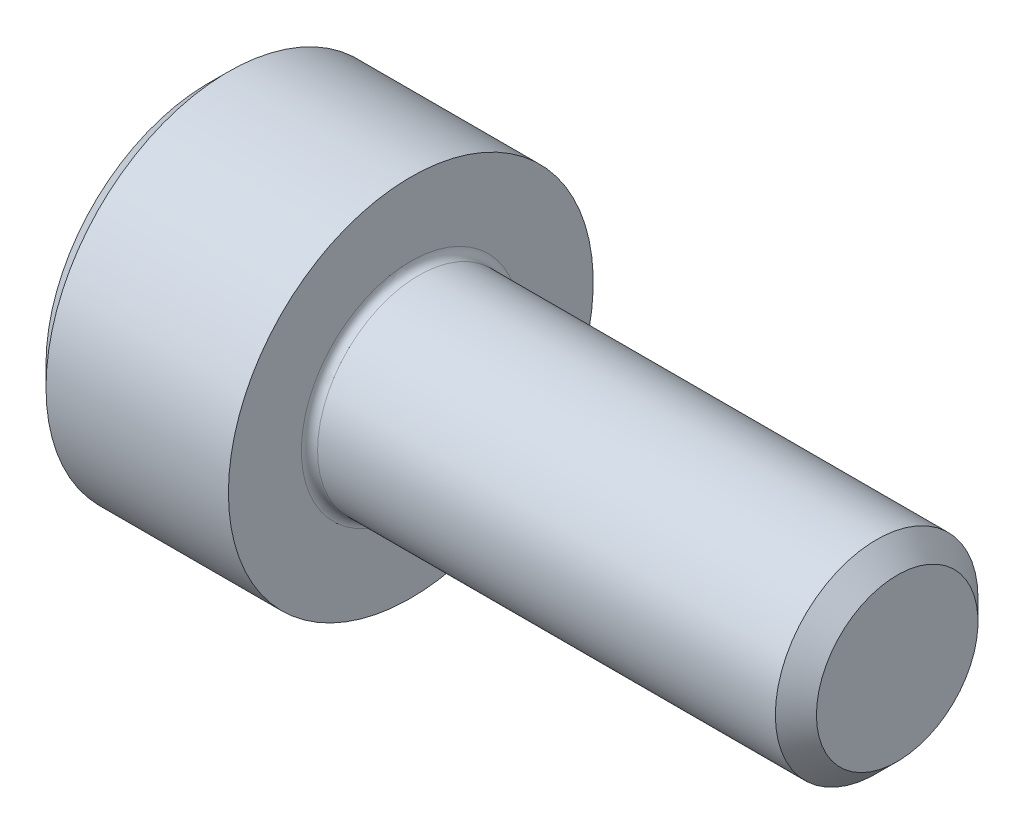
SolidWorks part; units mm, degrees
revolve "Base-Revolve" add sketch "BodySke"
sketch "BodySke" plane through (0, 0, 0) normal (0, 0, 1) x (1, 0, 0)
  line L0 (0, 0) -> (0, 2)
  line L1 (0.25, 2.25) -> (2.5, 2.25)
  line L2 (2.5, 2.25) -> (2.5, 1.25)
  line L3 (2.5, 1.25) -> (8.2465, 1.25)
  line L4 (8.5, 0.9965) -> (8.5, 0)
  line L5 (8.5, 0) -> (0, 0)
  line L6 (-31.75, 0) -> (127, 0) construction
  line L7 (0, 2) -> (0.25, 2.25)
  line L8 (8.5, 0.9965) -> (8.2465, 1.25)
  line L9 (0, -2) -> (0.25, -2.25) construction
  line L10 (8.5, -0.9965) -> (8.2465, -1.25) construction
  line L11 (2.95, 9.525) -> (2.95, 3.175) construction
  line L12 (2.5, 9.525) -> (2.5, 3.175) construction
  line L13 (-41.5, 9.525) -> (-41.5, 3.175) construction
  dimension "Diameter" = 2.5
  dimension "Head_ht" = 2.5
  dimension "Length" = 6
  dimension "Body_ch_ang" = 45
  dimension "Head_dia" = 4.5
  dimension "Head_ch_ang" = 45
  dimension "Minor_dia" = 1.993
  dimension "Advance" = 0.45
  dimension "Thread_nom" = 6
  dimension "Thread_length" = 50
  dimension "Head_ch_ht" = 0.25
fillet "Fillet1" radius 0.1 1 edges at (2.5, 0, 1.25)
ref_plane "Plane1" through (0, 0, 0) normal (0, 0, 1) x (1, 0, 0)
ref_plane "Plane2" through (0, 0, 0) normal (0, 1, 0) x (1, 0, 0)
ref_plane "Plane3" through (0, 0, 0) normal (1, 0, 0) x (0, 0, -1)
sketch "Sketch2" plane through (0, 0, 0) normal (0, 0, 1) x (1, 0, 0)
  line L0 (0, 1.0225) -> (1.1, 1.0225)
  line L1 (1.1, 1.0225) -> (1.6903, 0)
  line L2 (-31.75, 0) -> (127, 0) construction
  line L3 (1.6903, 0) -> (0, 0)
  line L4 (0, 0) -> (0, 1.0225)
  line L5 (0, 2) -> (0, -2) construction
  line L6 (0, 0) -> (47.625, 0) construction
  line L7 (2.5, -2.25) -> (2.5, 2.25) construction
revolve "Hex-PreBroach" cut sketch "Sketch2" angle 360 about L6
sketch "Sketch3" plane through (0, 0, 0) normal (-1, 0, 0) x (0, 0.5, 0.866)
  line L0 (0.5903, 1.0225) -> (-0.5903, 1.0225)
  line L1 (-0.5903, 1.0225) -> (-1.1807, 0)
  line L2 (0.5903, 1.0225) -> (1.1807, 0)
  line L3 (0.5903, -1.0225) -> (1.1807, 0)
  line L4 (0.5903, -1.0225) -> (-0.5903, -1.0225)
  line L5 (-0.5903, -1.0225) -> (-1.1807, 0)
extrude "Hex" cut sketch "Sketch3" against normal blind 1.1
sketch "Sketch4" plane through (0, 0, 0) normal (-1, 0, 0) x (0, 0, 1)
  line L0 (0, 0) -> (1.2446, 0)
  line L1 (0, 0) -> (6.1484, 3.5498) construction
  line L2 (0, 0) -> (0.6223, 1.0779)
  line L3 (1.0085, 0.2596) -> (1.19, 0.3644)
  line L4 (0.7291, 0.7436) -> (0.9106, 0.8484)
  arc A0 (1.0085, 0.2596) -> (0.7291, 0.7436) centre (0, 0) ccw
  arc A1 (1.2446, 0) -> (1.19, 0.3644) centre (0, 0) ccw
  arc A2 (0.6223, 1.0779) -> (0.9106, 0.8484) centre (0, 0) cw
extrude "Spline" [suppressed] cut sketch "Sketch4" against normal blind 1.1
pattern_circular "CirPattern1" [suppressed] count 6 every 60
sketch "Sketch5" plane through (0, 0, 0) normal (0, 0, 1) x (1, 0, 0)
  line L0 (-31.75, 0) -> (127, 0) construction
  line L2 (0, 2) -> (0, -2) construction
  circle A0 centre (0.1, 0) radius 0.005
  dimension "Drilled_hole_dia" = 0.01
  dimension "Drilled_hole_loc" = 0.1
extrude "Hole" [suppressed] cut sketch "Sketch5" against normal through all and the other way through all
pattern_circular "Drilled-4" [suppressed] count 2 every 60
pattern_circular "Drilled-6" [suppressed] count 3 every 60
sketch "ThdSchSke" plane through (0, 0, 0) normal (0, 0, 1) x (1, 0, 0)
  line L0 (2.95, -0.9965) -> (2.7725, -1.25)
  line L1 (2.95, -0.9965) -> (3.1275, -1.25)
  line L2 (3.1275, -1.25) -> (3.1275, -1.5625)
  line L3 (-3.175, 0) -> (5.1513, 0) construction
  line L5 (3.1275, -1.5625) -> (2.7725, -1.5625)
  line L6 (2.7725, -1.5625) -> (2.7725, -1.25)
  line L7 (0, 2) -> (0, -2) construction
revolve "ThreadSchematic" [suppressed] cut sketch "ThdSchSke" angle 360 about L3
pattern_linear "ThdSchPat" [suppressed]
equation "\"D2@Sketch3\" = \"Hex_size@Sketch3\" / 2"
equation "\"D1@Sketch3\" = \"Hex_size@Sketch3\" / 2"
equation "\"D1@Sketch2\" = \"Hex_size@Sketch3\" / 2"
equation "\"D3@Sketch4\" = \"Spline_p_dim@Sketch4\" / 2"
equation "\"Thread_minor@ThreadCosmetic\"  =  \"Minor_dia@BodySke\""
equation "\"D2@CirPattern1\" = 360 / \"Num_teeth@CirPattern1\""
equation "\"Wall_thickness@Sketch2\" = \"Head_ht@BodySke\" - \"Key_eng@Hex\""
equation "\"Thread_length@ThreadCosmetic\" = ((sgn( (\"Length@BodySke\" - \"Advance@BodySke\" ) - \"Thread_nom@BodySke\" )-1)*( (\"Length@BodySke\" - \"Advance@BodySke\" ) - \"Thread_nom@BodySke\" ))/-2+ \"Thread_nom@BodySke\""
equation "\"Thread_minor@ThdSchSke\" = \"Minor_dia@BodySke\""
equation "\"Diameter@ThdSchSke\" = \"Diameter@BodySke\""
equation "\"Overcut@ThdSchSke\" = \"Diameter@BodySke\" * 1.25"
equation "\"Start@ThdSchSke\" = \"Head_ht@BodySke\" + \"Length@BodySke\" - \"Thread_length@ThreadCosmetic\"  '---Non-countersunk---"
equation "\"Num_threads@ThdSchPat\" = int( \"Thread_length@ThreadCosmetic\" / \"Advance@BodySke\" + 0.999 )  + 1"
equation "\"Advance@ThdSchPat\" = \"Thread_length@ThreadCosmetic\" /  (\"Num_threads@ThdSchPat\" - 1) 'relax it"
equation "\"Num_threads@ThdSchPat\" = \"Num_threads@ThdSchPat\" - sgn( \"Num_threads@ThdSchPat\" - 1) '---chamfered tips only---"
